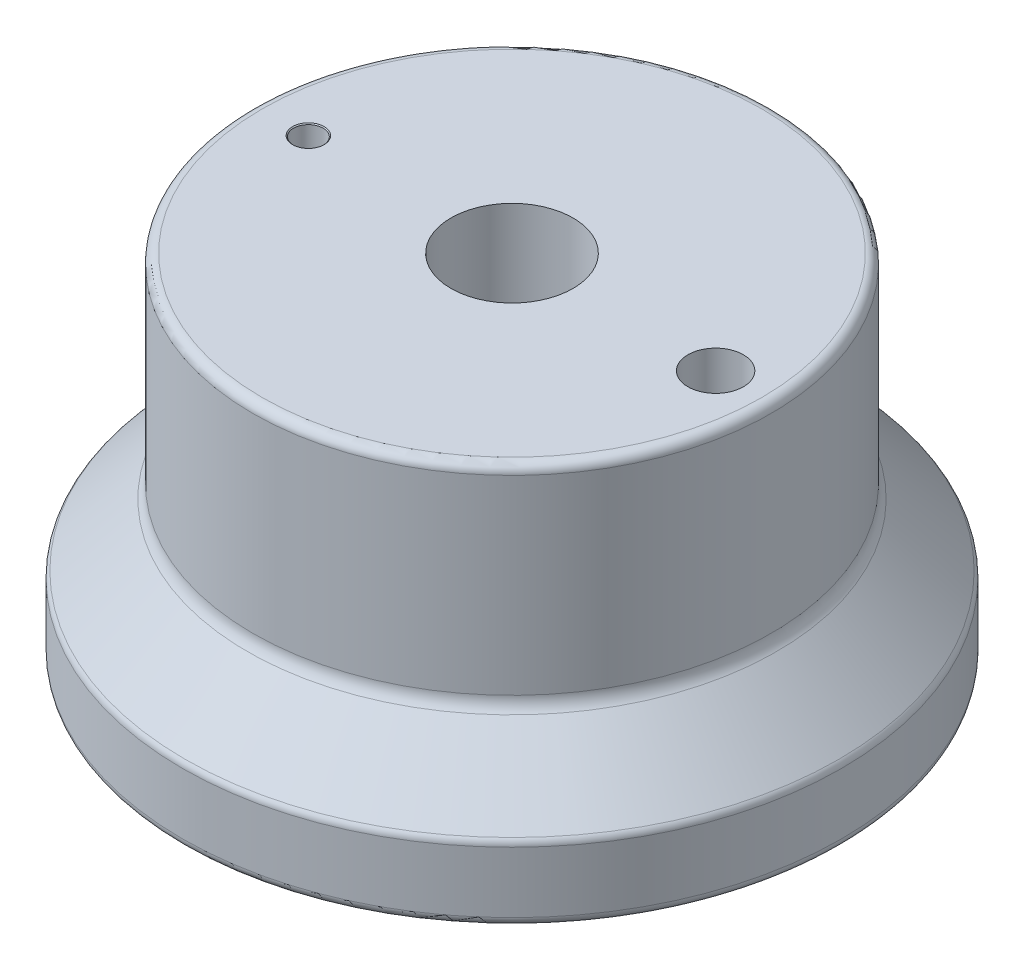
SolidWorks part; units mm, degrees
ref_plane "Front Plane" through (0, 0, 0) normal (0, 0, 1) x (1, 0, 0)
ref_plane "Top Plane" through (0, 0, 0) normal (0, 1, 0) x (1, 0, 0)
ref_plane "Right Plane" through (0, 0, 0) normal (1, 0, 0) x (0, 0, -1)
sketch "Sketch1" plane through (0, 0, 0) normal (0, 0, 1) x (1, 0, 0)
  line L0 (0, 0) -> (0, 9.5)
  line L1 (0, 9.5) -> (7, 9.5)
  line L2 (8.9, 2) -> (7, 3.9)
  line L3 (8.9, 2) -> (8.9, 12.5088) construction
  line L5 (8.9, 0) -> (0, 0)
  line L9 (8.9, 2) -> (8.9, 0)
  line L10 (7, 3.9) -> (7, 9.5)
  circle A0 centre (8, 4.3142) radius 1 construction
  point P3 (7, 3.9)
  point P8 (7, 4.3142)
  point P9 (9, 4.3142)
  dimension "D6" = 2
  dimension "D1" = 8.9
  dimension "D2" = 9.5
  dimension "D3" = 45
  dimension "D5" = 7
  dimension "D7" = 2
revolve "Revolve1" add sketch "Sketch1" angle 360 about L0
hole_wizard "Ø0.8 (0.8) Diameter Hole1" positions "Sketch3" profile "Sketch2" hole size "Ø0.8" standard "ANSI Metric"
sketch "Sketch3" plane through (0, 0, 0) normal (0, -1, 0) x (1, 0, 0)
  line L1 (8.9, 0) -> (-8.9, 0) construction
  circle A1 centre (0, 0) radius 8.9 construction
  point P0 (-5.5, 0)
  dimension "D1" = 5.5
sketch "Sketch2" plane through (-5.5, 0, 0) normal (1, 0, 0) x (0, 0, -1)
  line L0 (0, 0) -> (0, 9.5)
  line L1 (0, 9.5) -> (0.425, 9.5)
  line L2 (0.4, 9.475) -> (0.4, 0.0144)
  line L3 (0.4, 0.0144) -> (0.425, 0)
  line L5 (0.425, 0) -> (0, 0)
  line L6 (-0.4, 0.0144) -> (-0.425, 0) construction
  line L7 (0.425, 9.5) -> (0.4, 9.475)
  line L8 (-0.425, 9.5) -> (-0.4, 9.475) construction
  line L11 (0, -6.35) -> (0, 107.95) construction
  dimension "Thru Hole Dia." = 0.8
  dimension "Thru Hole Depth" = 9.5
  dimension "Near C'Sink Dia." = 0.85
  dimension "Near C'Sink Angle" = 120
  dimension "Far C'Sink Dia." = 0.85
  dimension "Far C'Sink Angle" = 90
hole_wizard "M4x0.7 Tapped Hole1" positions "Sketch7" profile "Sketch8" tap size "M4x0.7" standard "ANSI Metric"
sketch "Sketch7" plane through (0, 9.5, 0) normal (0, 1, 0) x (-1, 0, 0)
  line L0 (-7, 0) -> (7, 0) construction
  circle A0 centre (0, 0) radius 7 construction
  point P0 (0, 0)
  point P11 (0, 0)
sketch "Sketch8" plane through (0, 9.5, 0) normal (1, 0, 0) x (0, 0, 1)
  line L0 (0, 0) -> (0, 6.9914)
  line L1 (0, 6.9914) -> (1.65, 6)
  line L2 (1.65, 6) -> (1.65, 0)
  line L5 (1.65, 0) -> (0, 0)
  line L10 (0, 6.9914) -> (-1.65, 6) construction
  line L11 (0, -6.35) -> (0, 107.95) construction
  dimension "Tap Drill Dia." = 3.3
  dimension "Tap Drill Depth" = 6
  dimension "Drill Angle" = 118
fillet "Fillet1" radius 0.25 3 edges at (0, 0, -8.9) (0, 2, -8.9) (0, 9.5, -7)
fillet "Fillet2" radius 0.5 1 edges at (0, 3.9, -7)
hole_wizard "Ø1.5mm Dowel Hole1" positions "Sketch9" profile "Sketch10" hole size "Ø1.5" standard "ANSI Metric"
sketch "Sketch9" plane through (0, 9.5, 0) normal (0, 1, 0) x (1, 0, 0)
  line L0 (5.5, 0) -> (0, 0) construction
  point P0 (5.5, 0)
  dimension "D1" = 5.5
sketch "Sketch10" plane through (5.5, 9.5, 0) normal (1, 0, 0) x (0, 0, 1)
  line L0 (0, 0) -> (0, 4.25)
  line L1 (0, 4.25) -> (0.75, 3.5)
  line L2 (0.75, 3.5) -> (0.75, 0)
  line L5 (0.75, 0) -> (0, 0)
  line L10 (0, 4.25) -> (-0.75, 3.5) construction
  line L11 (0, -6.35) -> (0, 107.95) construction
  dimension "Hole Dia." = 1.5
  dimension "Hole Depth" = 3.5
  dimension "Drill Angle" = 90
